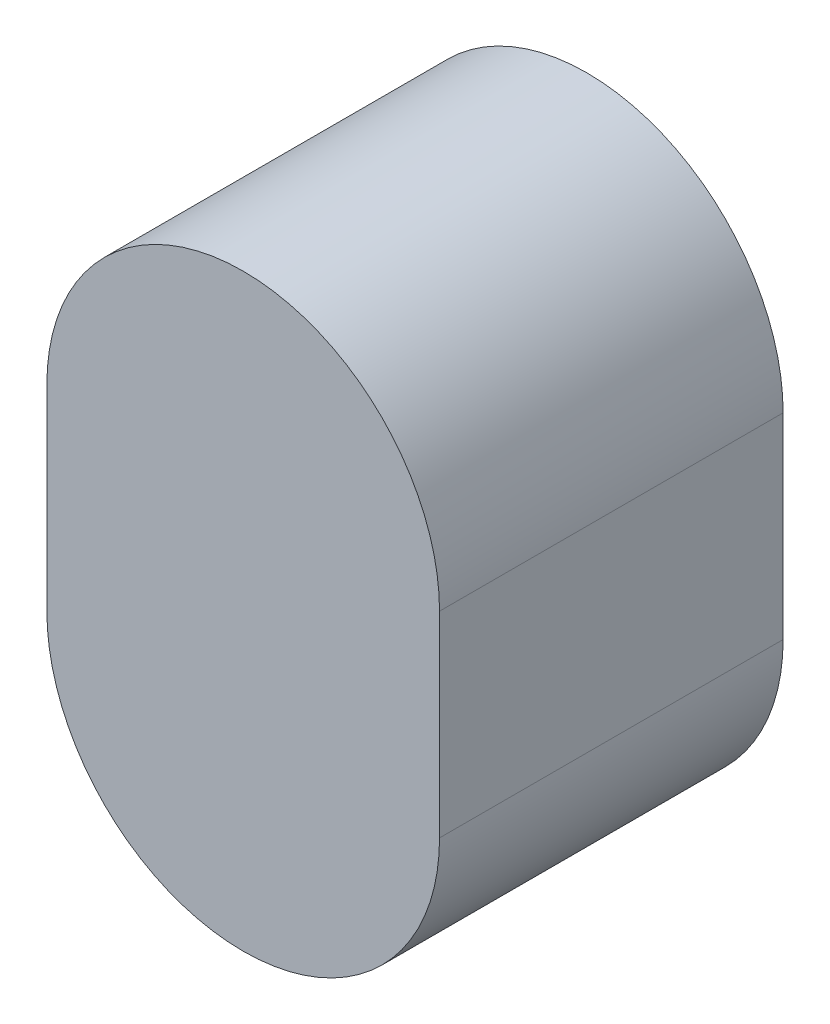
SolidWorks part; units mm, degrees
ref_plane "Plan1" through (0, 0, 0) normal (0, 0, 1) x (1, 0, 0)
ref_plane "Plan2" through (0, 0, 0) normal (0, 1, 0) x (1, 0, 0)
ref_plane "Plan3" through (0, 0, 0) normal (1, 0, 0) x (0, 0, -1)
sketch "Esquisse1" plane through (0, 0, 0) normal (0, 0, 1) x (1, 0, 0)
  line L0 (4, 0) -> (4, -4)
  line L1 (-4, 0) -> (-4, -4)
  arc A0 (4, 0) -> (-4, 0) centre (0, 0) ccw
  arc A1 (-4, -4) -> (4, -4) centre (0, -4) ccw
  dimension "D1" = 4
  dimension "D2" = 4
extrude "Base-Extrusion" add sketch "Esquisse1" along normal blind 7
